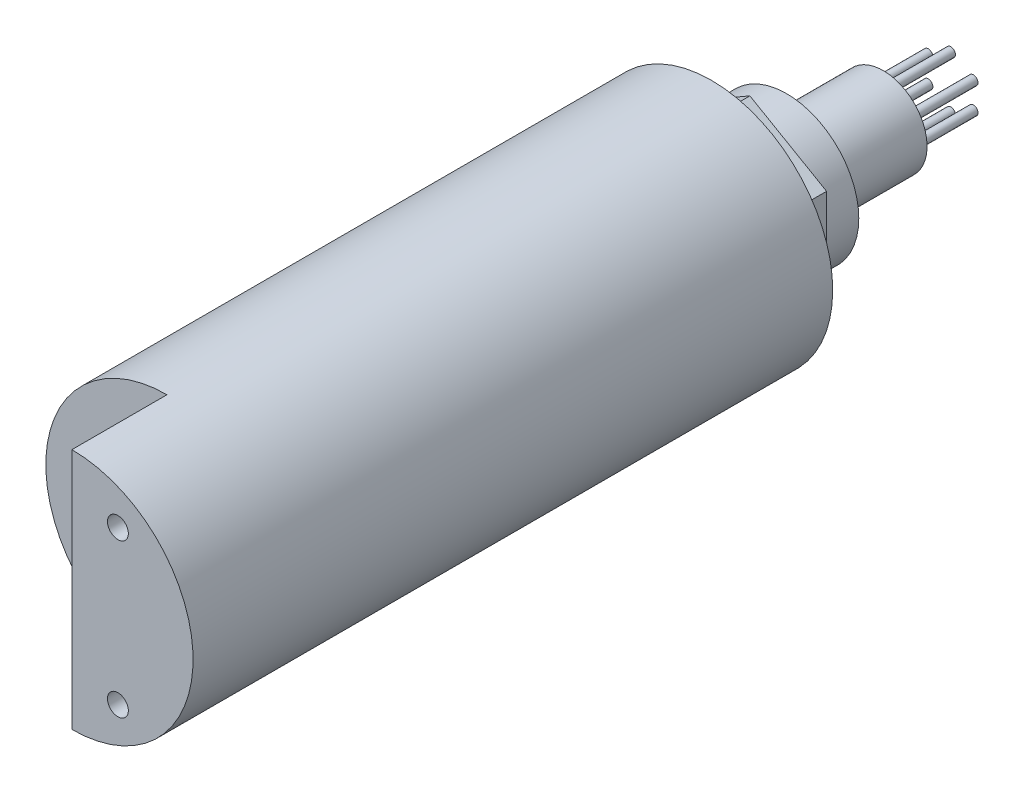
SolidWorks part; units mm, degrees
ref_plane "Front Plane" through (0, 0, 0) normal (0, 0, 1) x (1, 0, 0)
ref_plane "Top Plane" through (0, 0, 0) normal (0, 1, 0) x (1, 0, 0)
ref_plane "Right Plane" through (0, 0, 0) normal (1, 0, 0) x (0, 0, -1)
sketch "Sketch1" plane through (0, 0, 0) normal (0, 0, 1) x (1, 0, 0)
  circle A0 centre (0, 0) radius 20.066
  dimension "D1" = 40.132
extrude "main_body" add sketch "Sketch1" along normal blind 90.17
sketch "Sketch2" plane through (0, 0, 90.17) normal (0, 0, 1) x (1, 0, 0)
  line L0 (0, 0) -> (0, 20.066) construction
  line L1 (0, 0) -> (0, -20.066) construction
  line L2 (0, 20.066) -> (0, -20.066)
  arc A0 (0, -20.066) -> (0, 20.066) centre (0, 0) ccw
extrude "optic_flange" add sketch "Sketch2" along normal blind 15.748
sketch "Sketch3" plane through (0, 0, 90.17) normal (0, 0, 1) x (1, 0, 0)
  line L0 (0, 0) -> (-7.874, 0) construction
  circle A0 centre (-7.874, 0) radius 6.35
  dimension "D1" = 12.7
  dimension "D2" = 7.874
extrude "optic1" add sketch "Sketch3" along normal blind 0.508
sketch "Sketch4" plane through (0, 0, 0) normal (-1, 0, 0) x (0, 0, 1)
  line L0 (90.17, 0) -> (96.266, 0) construction
  line L1 (90.17, -20.066) -> (90.17, 20.066) construction
  circle A0 centre (96.266, 0) radius 4.572
  dimension "D1" = 9.144
  dimension "D2" = 6.096
extrude "optic2" cut sketch "Sketch4" against normal blind 0.508
sketch "Sketch5" plane through (0, 0, 105.918) normal (0, 0, 1) x (1, 0, 0)
  line L0 (0, 0) -> (7.62, 0) construction
  line L1 (7.62, 0) -> (7.62, 12.7) construction
  circle A0 centre (7.62, 12.7) radius 1.7272
  circle A1 centre (7.62, -12.7) radius 1.7272
  dimension "D3" = 3.4544
  dimension "D1" = 7.62
  dimension "D2" = 12.7
extrude "cap_mount_holes" cut sketch "Sketch5" against normal blind 6.35
sketch "Sketch6" plane through (0, 0, 0) normal (0, 0, -1) x (-1, 0, 0)
  line L1 (0, -14.6647) -> (12.7, -7.3323)
  line L2 (12.7, -7.3323) -> (12.7, 7.3323)
  line L3 (12.7, 7.3323) -> (0, 14.6647)
  line L4 (0, 14.6647) -> (-12.7, 7.3323)
  line L5 (-12.7, 7.3323) -> (-12.7, -7.3323)
  line L6 (-12.7, -7.3323) -> (0, -14.6647)
  circle A0 centre (0, 0) radius 12.7 construction
  dimension "D1" = 25.4
extrude "uw_hex" add sketch "Sketch6" along normal blind 6.35
sketch "Sketch7" plane through (0, 0, -6.35) normal (0, 0, -1) x (-1, 0, 0)
  circle A0 centre (0, 0) radius 11.938
  dimension "D1" = 23.876
extrude "uw_base" add sketch "Sketch7" along normal blind 6.096
sketch "Sketch8" plane through (0, 0, -12.446) normal (0, 0, -1) x (-1, 0, 0)
  circle A0 centre (0, 0) radius 7.239
  dimension "D1" = 14.478
extrude "uw_bore_plug" add sketch "Sketch8" along normal blind 16.002
sketch "Sketch9" plane through (0, 0, -28.448) normal (0, 0, -1) x (-1, 0, 0)
  line L0 (0, 0) -> (0, 4.318) construction
  circle A0 centre (0, 4.318) radius 0.762
  circle A1 centre (3.7395, 2.159) radius 0.762
  circle A2 centre (3.7395, -2.159) radius 0.762
  circle A3 centre (0, -4.318) radius 0.762
  circle A4 centre (-3.7395, -2.159) radius 0.762
  circle A5 centre (-3.7395, 2.159) radius 0.762
  dimension "D2" = 1.524
  dimension "D1" = 4.318
extrude "uw_pins" add sketch "Sketch9" along normal blind 11.176
